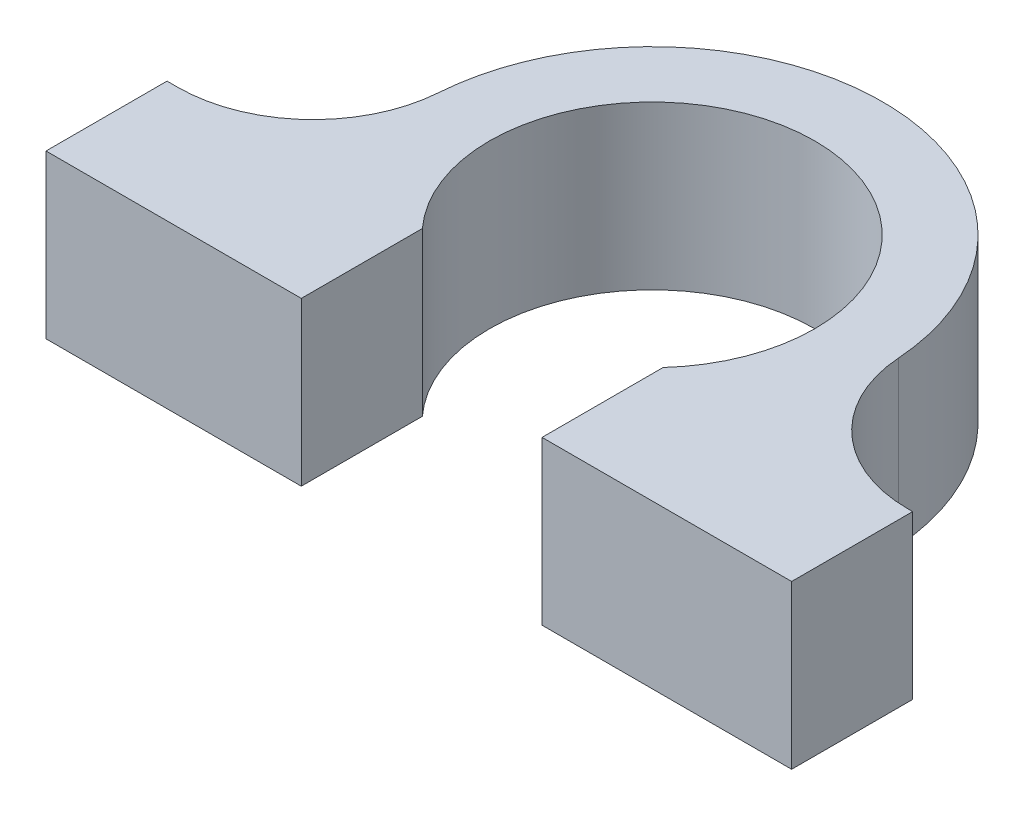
SolidWorks part; units mm, degrees
ref_plane "Front" through (0, 0, 0) normal (0, 0, 1) x (1, 0, 0)
ref_plane "Top" through (0, 0, 0) normal (0, 1, 0) x (1, 0, 0)
ref_plane "Right" through (0, 0, 0) normal (1, 0, 0) x (0, 0, -1)
sketch "Sketch1" plane through (0, 0, 0) normal (0, 1, 0) x (1, 0, 0)
  line L0 (0, 20.579) -> (0, -17) construction
  line L1 (-21.4705, 0) -> (19.2417, 0) construction
  line L2 (26.9311, -8.072) -> (27.2889, -8.072)
  line L3 (-27.7111, -8.072) -> (-26.9311, -8.072)
  line L4 (-27.7111, -8.072) -> (-27.7111, -17)
  line L6 (27.2889, -8.072) -> (27.2889, -17)
  line L7 (-8.8794, -8.072) -> (-8.8794, -17)
  line L8 (8.8794, -8.072) -> (8.8794, -17)
  line L9 (-27.7111, -17) -> (-8.8794, -17)
  line L10 (8.8794, -17) -> (27.2889, -17)
  arc A0 (8.8794, -8.072) -> (-8.8794, -8.072) centre (0, 0) ccw
  arc A1 (16.9566, 1.2139) -> (-16.9566, 1.2139) centre (0, 0) ccw
  arc A2 (-16.9566, 1.2139) -> (-26.9311, -8.072) centre (-26.9311, 1.928) cw
  circle A3 centre (0, 0) radius 17 construction
  circle A4 centre (0, 0) radius 12 construction
  arc A5 (16.9566, 1.2139) -> (26.9311, -8.072) centre (26.9311, 1.928) ccw
  point P4 (11.4757, 3.5085)
  point P9 (0, -17)
  point P14 (17, 0)
  dimension "D1" = 12
  dimension "D3" = 10
  dimension "D4" = 55
  dimension "D2" = 5
extrude "Boss-Extrude1" add sketch "Sketch1" along normal blind 12
